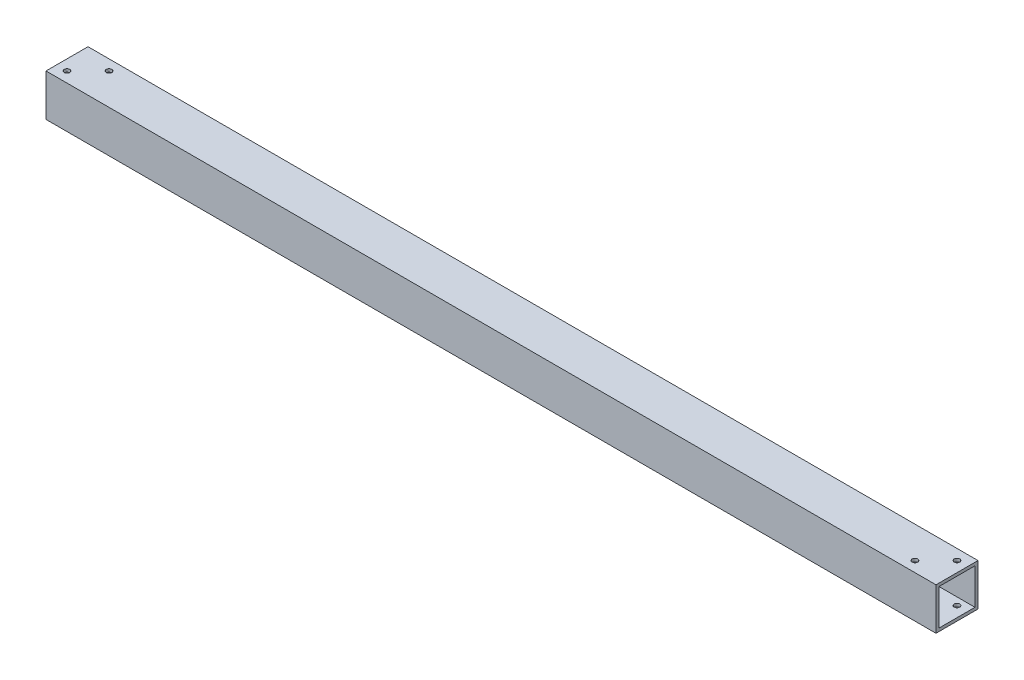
SolidWorks part; units mm, degrees
ref_plane "Front" through (0, 0, 0) normal (0, 0, 1) x (1, 0, 0)
ref_plane "Top" through (0, 0, 0) normal (0, 1, 0) x (1, 0, 0)
ref_plane "Right" through (0, 0, 0) normal (1, 0, 0) x (0, 0, -1)
sketch "Sketch1" plane through (0, 0, 0) normal (1, 0, 0) x (0, 0, -1)
  line L1 (0, 0) -> (50.8, 0)
  line L2 (0, 0) -> (0, 50.8)
  line L3 (0, 50.8) -> (50.8, 50.8)
  line L4 (50.8, 0) -> (50.8, 50.8)
  line L5 (3.6576, 47.1424) -> (47.1424, 47.1424)
  line L6 (3.6576, 47.1424) -> (3.6576, 3.6576)
  line L7 (3.6576, 3.6576) -> (47.1424, 3.6576)
  line L8 (47.1424, 47.1424) -> (47.1424, 3.6576)
  dimension "D1" = 50.8
  dimension "D2" = 50.8
  dimension "D3" = 3.6576
  dimension "D4" = 3.6576
  dimension "D5" = 3.6576
  dimension "D6" = 3.6576
extrude "Extrude1" add sketch "Sketch1" along normal blind 1076.198
sketch "Sketch3" plane through (0, 50.8, 0) normal (0, 1, 0) x (1, 0, 0)
  line L0 (0, 50.8) -> (0, 0) construction
  line L1 (0, 25.4) -> (1076.198, 25.4) construction
  line L2 (1076.198, 50.8) -> (1076.198, 0) construction
  circle A0 centre (12.7, 12.7) radius 3.3731
  circle A1 centre (38.1, 38.1) radius 3.3731
  circle A2 centre (1063.498, 38.1) radius 3.3731
  circle A3 centre (1038.098, 12.7) radius 3.3731
  dimension "D1" = 6.7462
  dimension "D7" = 25.4
  dimension "D8" = 12.7
  dimension "D9" = 12.7
  dimension "D2" = 12.7
  dimension "D3" = 38.1
  dimension "D4" = 12.7
  dimension "D5" = 25.4
  dimension "D6" = 12.7
extrude "Cut-Extrude1" cut sketch "Sketch3" against normal through all
